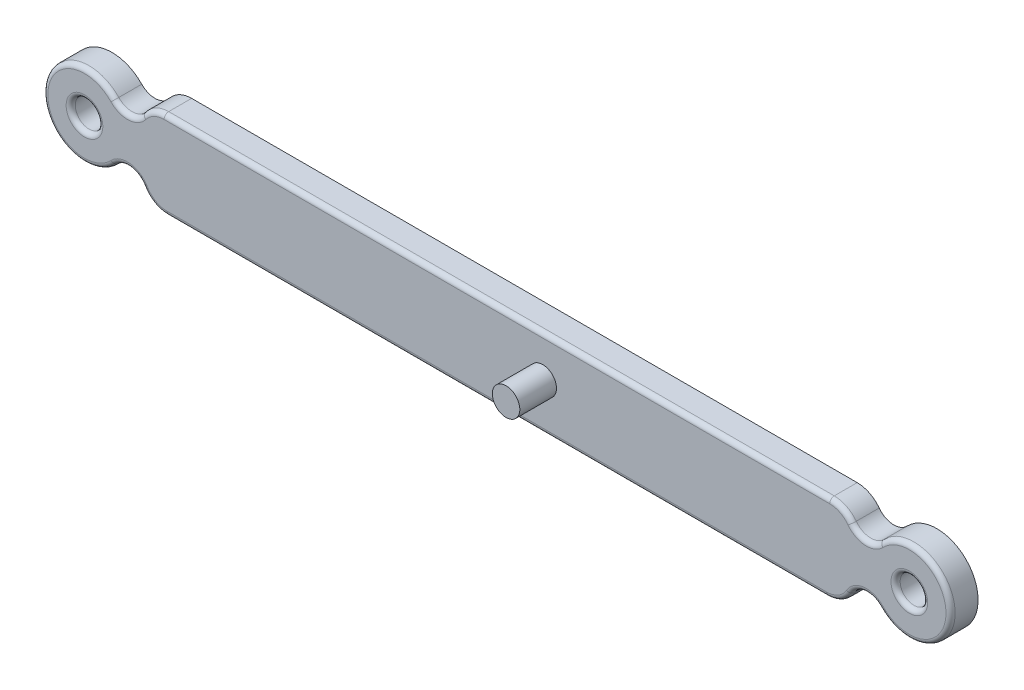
SolidWorks part; units mm, degrees
ref_plane "Plan de face" through (0, 0, 0) normal (0, 0, 1) x (1, 0, 0)
ref_plane "Plan de dessus" through (0, 0, 0) normal (0, 1, 0) x (1, 0, 0)
ref_plane "Plan de droite" through (0, 0, 0) normal (1, 0, 0) x (0, 0, -1)
sketch "Esquisse1" plane through (0, 0, 0) normal (0, 0, 1) x (1, 0, 0)
  line L0 (86.9042, 45) -> (813.0958, 45)
  line L2 (90.2054, -50) -> (809.7946, -50)
  circle A0 centre (0, 0) radius 15
  circle A1 centre (900, 0) radius 15
  arc A2 (32.4721, 31.1538) -> (32.4721, -31.1538) centre (0, 0) ccw
  arc A3 (867.5279, -31.1538) -> (867.5279, 31.1538) centre (900, 0) ccw
  arc A4 (32.4721, 31.1538) -> (62.9042, 33) centre (46.9042, 45) ccw
  arc A5 (64.2247, -35) -> (32.4721, -31.1538) centre (46.9042, -45) ccw
  arc A6 (837.0958, 33) -> (867.5279, 31.1538) centre (853.0958, 45) ccw
  arc A7 (867.5279, -31.1538) -> (835.7753, -35) centre (853.0958, -45) ccw
  arc A8 (62.9042, 33) -> (86.9042, 45) centre (86.9042, 15) cw
  arc A9 (64.2247, -35) -> (90.2054, -50) centre (90.2054, -20) ccw
  arc A10 (837.0958, 33) -> (813.0958, 45) centre (813.0958, 15) ccw
  arc A11 (809.7946, -50) -> (835.7753, -35) centre (809.7946, -20) ccw
  dimension "D1" = 30
  dimension "D2" = 30
  dimension "D4" = 90
  dimension "D5" = 90
  dimension "D6" = 40
  dimension "D7" = 40
  dimension "D8" = 40
  dimension "D9" = 40
  dimension "D10" = 30
  dimension "D11" = 30
  dimension "D12" = 30
  dimension "D3" = 900
extrude "Extrusion1" add sketch "Esquisse1" along normal blind 30
fillet "Congé1" radius 5 14 edges at (915, 0, 30) (450, 45, 30) (826.5123, 41.8328, 30) (851.8848, 25.0367, 30) (945, 0, 30) (850.6908, -25.1451, 30) (824.7946, -45.9808, 30) (450, -50, 30) (75.2054, -45.9808, 30) (49.3092, -25.1451, 30) (-45, 0, 30) (48.1152, 25.0367, 30) (73.4877, 41.8328, 30) (15, 0, 30)
sketch "Esquisse2" plane through (0, 0, 30) normal (0, 0, 1) x (1, 0, 0)
  circle A0 centre (500, 0) radius 15
  dimension "D1" = 30
  dimension "D2" = 500
extrude "Extrusion2" add sketch "Esquisse2" against normal mid plane 80
chamfer "Chanfrein1" distance 1 angle 45 1 edges at (515, 0, -10)
